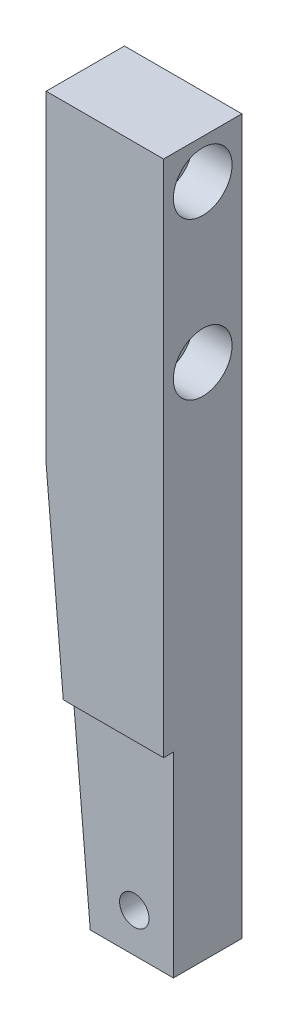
SolidWorks part; units mm, degrees
ref_plane "Front Plane" through (0, 0, 0) normal (0, 0, 1) x (1, 0, 0)
ref_plane "Top Plane" through (0, 0, 0) normal (0, 1, 0) x (1, 0, 0)
ref_plane "Right Plane" through (0, 0, 0) normal (1, 0, 0) x (0, 0, -1)
sketch "Sketch1" plane through (0, 0, 0) normal (0, 0, 1) x (1, 0, 0)
  line L0 (0, 0) -> (19.05, 0)
  line L1 (19.05, 0) -> (19.05, -115.8748)
  line L2 (19.05, -115.8748) -> (0, -115.8748)
  line L3 (0, -115.8748) -> (0, 0)
  line L4 (0, -6.35) -> (19.05, -6.35) construction
  line L5 (0, -31.75) -> (19.05, -31.75) construction
  circle A0 centre (12.7, -109.5248) radius 2.3876
  dimension "D3" = 4.7752
  dimension "D1" = 115.8748
  dimension "D2" = 19.05
  dimension "D4" = 109.5248
  dimension "D5" = 6.35
  dimension "D6" = 6.35
  dimension "D7" = 25.4
  dimension "D8" = 6.35
sketch "Sketch2" plane through (0, 0, 0) normal (0, 0, 1) x (1, 0, 0)
  line L0 (19.05, -115.8748) -> (0, -115.8748) construction
  line L1 (0, -115.8748) -> (0, 0) construction
  line L2 (0, 0) -> (19.05, 0) construction
  line L3 (19.05, 0) -> (19.05, -115.8748) construction
  line L4 (19.05, -115.8748) -> (0, -115.8748)
  line L5 (0, -115.8748) -> (0, 0)
  line L6 (0, 0) -> (19.05, 0)
  line L7 (19.05, 0) -> (19.05, -115.8748)
  circle A0 centre (12.7, -109.5248) radius 2.3876 construction
  circle A1 centre (12.7, -109.5248) radius 2.3876
extrude "Boss-Extrude2" add sketch "Sketch2" along normal mid plane 12.7
chamfer "Chamfer1" distance 63.5 angle 5 1 edges at (0, -115.8748, 0)
hole_wizard "CBORE for 1/4 Socket Head Cap Screw1" positions "Sketch6" profile "Sketch5" counterbore size "1/4" standard "ANSI Inch"
sketch "Sketch6" plane through (19.05, 0, 0) normal (1, 0, 0) x (0, 0, -1)
  point P0 (0, -6.35)
  point P3 (0, -31.75)
sketch "Sketch5" plane through (19.05, -6.35, 0) normal (0, 1, 0) x (0, 0, -1)
  line L0 (0, 0) -> (0, 19.05)
  line L1 (0, 19.05) -> (3.175, 19.05)
  line L3 (3.175, 19.05) -> (3.175, 6.35)
  line L4 (3.175, 6.35) -> (4.7625, 6.35)
  line L5 (4.7625, 6.35) -> (4.7625, 0)
  line L7 (4.7625, 0) -> (0, 0)
  line L11 (0, -6.35) -> (0, 107.95) construction
  dimension "Thru Hole Dia." = 6.35
  dimension "Thru Hole Depth" = 19.05
  dimension "C'Bore Dia." = 9.525
  dimension "C'Bore Depth" = 6.35
sketch "Sketch7" plane through (0, 0, 0) normal (1, 0, 0) x (0, 0, -1)
  line L0 (-14.9098, -84.1248) -> (-4.7498, -84.1248)
  line L1 (-4.7498, -84.1248) -> (-4.7498, -122.2248)
  line L2 (-4.7498, -122.2248) -> (-14.9098, -122.2248)
  line L3 (-14.9098, -122.2248) -> (-14.9098, -84.1248)
  line L4 (-6.35, -115.8748) -> (6.35, -115.8748) construction
  dimension "D1" = 4.7498
  dimension "D2" = 10.16
  dimension "D3" = 38.1
  dimension "D4" = 31.75
extrude "Cut-Extrude1" cut sketch "Sketch7" along normal blind 30.48
